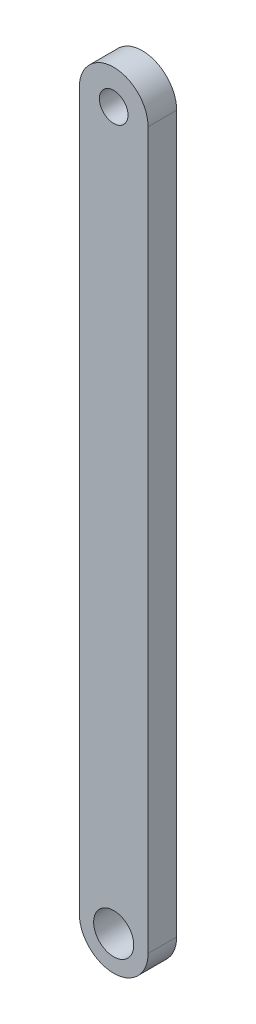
SolidWorks part; units mm, degrees
ref_plane "Front Plane" through (0, 0, 0) normal (0, 0, 1) x (1, 0, 0)
ref_plane "Top Plane" through (0, 0, 0) normal (0, 1, 0) x (1, 0, 0)
ref_plane "Right Plane" through (0, 0, 0) normal (1, 0, 0) x (0, 0, -1)
sketch "Sketch1" plane through (0, 0, 0) normal (0, 0, 1) x (1, 0, 0)
  line L0 (0, 0) -> (0, -250) construction
  line L1 (-12, 0) -> (-12, -250)
  line L2 (12, 0) -> (12, -250)
  arc A0 (-12, 0) -> (12, 0) centre (0, 0) cw
  arc A1 (-12, -250) -> (12, -250) centre (0, -250) ccw
  circle A2 centre (0, 0) radius 5
  circle A3 centre (0, -250) radius 7
  dimension "D4" = 14
  dimension "D5" = 10
  dimension "D1" = 250
  dimension "D2" = 12
  dimension "D3" = 12
extrude "Extrude1" add sketch "Sketch1" along normal blind 10
